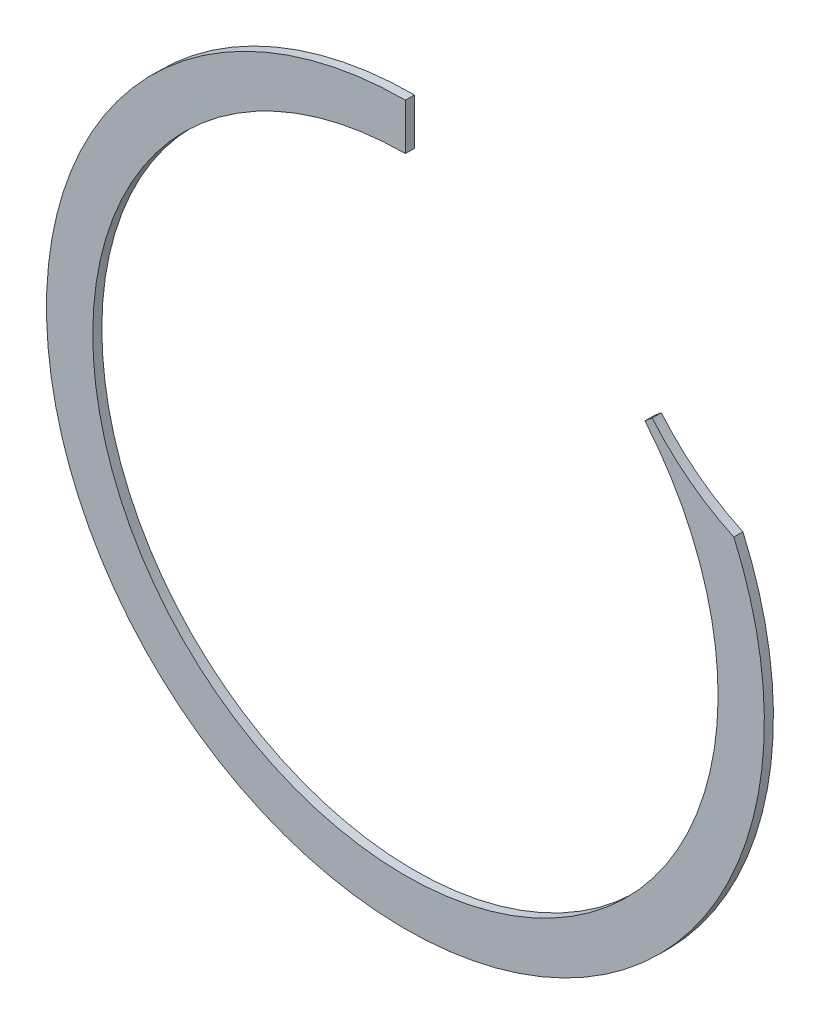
SolidWorks part; units mm, degrees
ref_plane "Front" through (0, 0, 0) normal (0, 0, 1) x (1, 0, 0)
ref_plane "Top" through (0, 0, 0) normal (0, 1, 0) x (1, 0, 0)
ref_plane "Right" through (0, 0, 0) normal (1, 0, 0) x (0, 0, -1)
sketch "Sketch1" plane through (0, 0, 0) normal (0, 0, 1) x (1, 0, 0)
  circle A0 centre (0, 0) radius 31.1277
  circle A1 centre (0, 0) radius 27.1145
  dimension "D1" = 62.2554
  dimension "D2" = 54.229
extrude "Extrude1" add sketch "Sketch1" along normal blind 0.7874
sketch "Sketch2" plane through (0, 0, 0) normal (0, 0, 1) x (1, 0, 0)
  line L0 (21.4033, 17.9595) -> (0, 0)
  line L1 (0, 0) -> (0, 31.1277)
  line L2 (0, 0) -> (36.9693, 31.0209) construction
  line L3 (0, 31.1277) -> (16.6496, 31.1277)
  arc A2 (21.4033, 17.9595) -> (16.6496, 31.1277) centre (36.9693, 31.0209) ccw
  circle A3 centre (0, 0) radius 31.1277 construction
  dimension "D2" = 50
  dimension "D1" = 20.32
  dimension "D3" = 48.26
extrude "Cut-Extrude1" cut sketch "Sketch2" along normal through all
